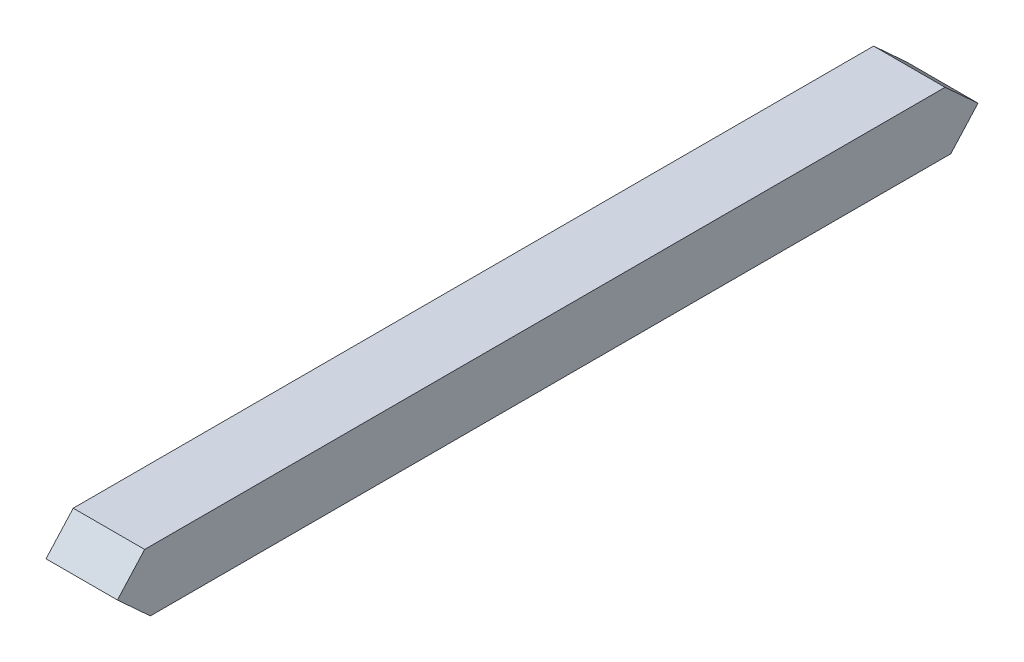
SolidWorks part; units mm, degrees
ref_plane "Plan de face" through (0, 0, 0) normal (0, 0, 1) x (1, 0, 0)
ref_plane "Plan de dessus" through (0, 0, 0) normal (0, 1, 0) x (1, 0, 0)
ref_plane "Plan de droite" through (0, 0, 0) normal (1, 0, 0) x (0, 0, -1)
sketch "Esquisse1" plane through (0, 0, 0) normal (0, 0, 1) x (1, 0, 0)
  line L1 (-32.5, 27.5) -> (32.5, 27.5)
  line L2 (-32.5, 27.5) -> (-32.5, -27.5)
  line L3 (-32.5, -27.5) -> (32.5, -27.5)
  line L4 (32.5, 27.5) -> (32.5, -27.5)
  line L5 (-32.5, 27.5) -> (32.5, -27.5) construction
  line L6 (-32.5, -27.5) -> (32.5, 27.5) construction
  point P0 (0, 0)
  dimension "D1" = 55
  dimension "D2" = 65
extrude "Boss.-Extru.1" add sketch "Esquisse1" along normal blind 783
sketch "Esquisse3" plane through (0, 0, 0) normal (1, 0, 0) x (0, 0, -1)
  line L0 (-783, -27.5) -> (-783, 27.5) construction
  line L1 (-783, 0) -> (-753.0429, -27.5)
  line L2 (-783, -27.5) -> (0, -27.5) construction
  line L3 (-753.0429, -27.5) -> (-783, -27.5)
  line L4 (-783, -27.5) -> (-783, 0)
  line L5 (-783, 0) -> (-758.2271, 27.5)
  line L6 (-783, 27.5) -> (0, 27.5) construction
  line L7 (-758.2271, 27.5) -> (-783, 27.5)
  line L8 (-783, 27.5) -> (-783, 0)
  line L9 (-24.7729, -27.5) -> (0, -27.5)
  line L10 (0, 0) -> (-24.7729, -27.5)
  line L11 (0, -27.5) -> (0, 0)
  line L12 (0, 0) -> (-29.9571, 27.5)
  line L13 (0, 27.5) -> (0, 0)
  line L14 (-29.9571, 27.5) -> (0, 27.5)
  arc A0 (-783, -23.0337) -> (-765.9365, -15.4722) centre (-783, 0) ccw
  arc A1 (-783, 22.8466) -> (-767.6535, 16.9248) centre (-783, 0) cw
  point P0 (-783, 0)
  point P13 (-391.5, 27.5)
  point P19 (-391.5, 0)
  point P27 (-391.5, 0)
  dimension "D1" = 2
extrude "Enlèv. mat.-Extru.1" cut sketch "Esquisse3" against normal through all both and the other way through all contours L5 L7 L8 | L1 L3 L4 | L12 L14 L13 | L10 L9 L11
